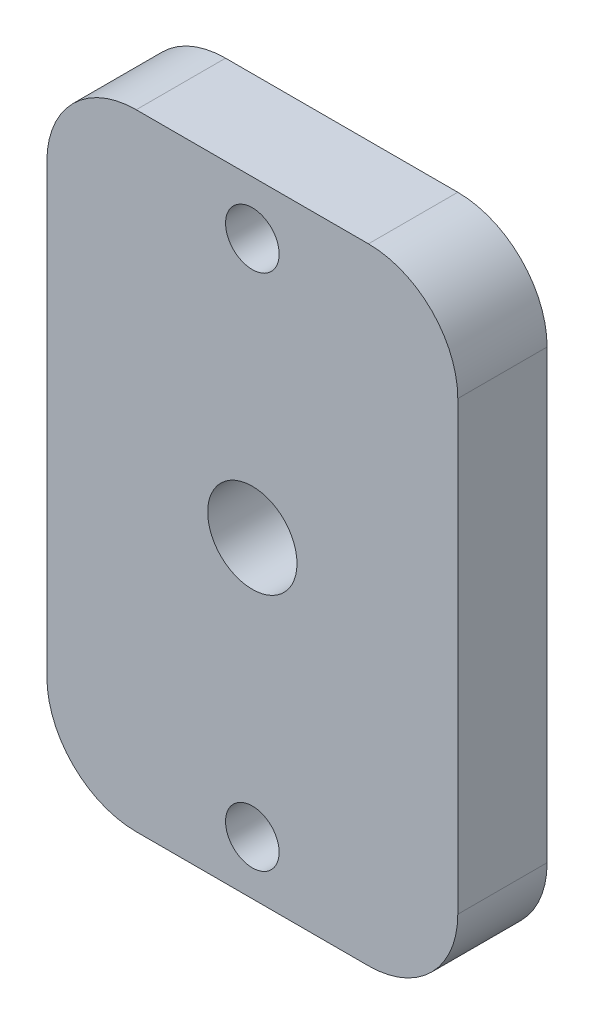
SolidWorks part; units mm, degrees
ref_plane "Plan de face" through (0, 0, 0) normal (0, 0, 1) x (1, 0, 0)
ref_plane "Plan de dessus" through (0, 0, 0) normal (0, 1, 0) x (1, 0, 0)
ref_plane "Plan de droite" through (0, 0, 0) normal (1, 0, 0) x (0, 0, -1)
sketch "Esquisse1" plane through (0, 0, 0) normal (0, 0, 1) x (1, 0, 0)
  line L0 (0, 0) -> (22.8241, 0) construction
  line L1 (0, 14.5) -> (0, -14.5) construction
  line L3 (-11.5, 17.5) -> (11.5, 17.5)
  line L4 (-11.5, 17.5) -> (-11.5, -17.5)
  line L5 (-11.5, -17.5) -> (11.5, -17.5)
  line L6 (11.5, 17.5) -> (11.5, -17.5)
  circle A0 centre (0, 0) radius 2.5
  circle A1 centre (0, 14.5) radius 1.5
  circle A2 centre (0, -14.5) radius 1.5
  dimension "D2" = 5
  dimension "D3" = 3
  dimension "D1" = 29
  dimension "D4" = 23
  dimension "D5" = 3
extrude "Boss.-Extru.1" add sketch "Esquisse1" along normal blind 5
fillet "Congé1" radius 5 4 edges at (11.5, -17.5, 2.5) (-11.5, -17.5, 2.5) (-11.5, 17.5, 2.5) (11.5, 17.5, 2.5)
